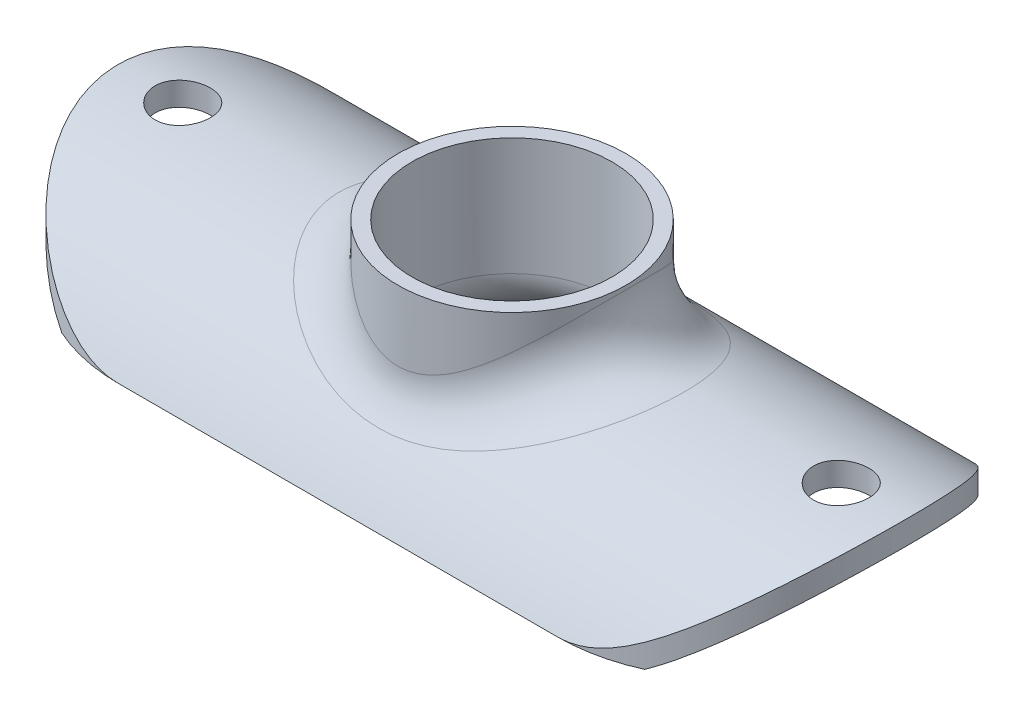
SolidWorks part; units mm, degrees
ref_plane "Plan de face" through (0, 0, 0) normal (0, 0, 1) x (1, 0, 0)
ref_plane "Plan de dessus" through (0, 0, 0) normal (0, 1, 0) x (1, 0, 0)
ref_plane "Plan de droite" through (0, 0, 0) normal (1, 0, 0) x (0, 0, -1)
sketch "Esquisse1" plane through (0, 0, 0) normal (1, 0, 0) x (0, 0, -1)
  line L0 (-13.5, 0) -> (13.5, 0) construction
  line L1 (-14.8182, 0) -> (-13.5, 0)
  line L2 (13.5, 0) -> (14.8182, 0)
  arc A0 (-13.5, 0) -> (13.5, 0) centre (0, -10.332) cw
  arc A1 (-14.8182, 0) -> (14.8182, 0) centre (0, -8.332) cw
  point P7 (0, 0)
  point P8 (-14.7984, 0)
  point P9 (14.8346, 0)
  dimension "D1" = 17
  dimension "D3" = 2
  dimension "D2" = 27
extrude "Boss.-Extru.1" add sketch "Esquisse1" along normal mid plane 67
sketch "Esquisse2" plane through (0, 0, 0) normal (0, 1, 0) x (1, 0, 0)
  line L0 (-18.6818, 0) -> (18.6818, 0) construction
  line L1 (-18.6818, 14.8182) -> (18.6818, 14.8182)
  line L2 (-18.6818, -14.8182) -> (18.6818, -14.8182)
  line L3 (33.5, 14.8182) -> (-33.5, 14.8182) construction
  line L4 (-33.5, 14.8182) -> (-33.5, -14.8182) construction
  line L5 (33.5, -14.8182) -> (33.5, 14.8182) construction
  line L6 (-44.8067, 22.3774) -> (40.3627, 22.3774)
  line L7 (-44.8067, 22.3774) -> (-44.8067, -24.5831)
  line L8 (40.3627, 22.3774) -> (40.3627, -24.5831)
  line L9 (-44.8067, -24.5831) -> (40.3627, -24.5831)
  arc A0 (-18.6818, 14.8182) -> (-18.6818, -14.8182) centre (-18.6818, 0) ccw
  arc A1 (18.6818, -14.8182) -> (18.6818, 14.8182) centre (18.6818, 0) ccw
  circle A2 centre (0, 0) radius 8.5
  point P3 (0, 0)
  point P12 (-33.5, 0)
  point P15 (33.5, 0)
  point P18 (0, 0)
  point P21 (0, 0)
  dimension "D1" = 17
extrude "Enlèv. mat.-Extru.1" cut sketch "Esquisse2" along normal through all contours L7 L9 L8 L6 A1 L2 A0 L1 | L0 A2 | A2 L0
sketch "Esquisse3" plane through (0, 0, 0) normal (0, 1, 0) x (1, 0, 0)
  line L0 (-9.75, 0) -> (9.75, 0) construction
  line L1 (-9.75, 9.75) -> (9.75, 9.75)
  line L2 (-9.75, -9.75) -> (9.75, -9.75)
  arc A0 (-9.75, 9.75) -> (-9.75, -9.75) centre (-9.75, 0) ccw
  arc A1 (9.75, -9.75) -> (9.75, 9.75) centre (9.75, 0) ccw
  circle A2 centre (0, 0) radius 8.5 construction
  circle A3 centre (0, 0) radius 8.5
  point P3 (0, 0)
  point P8 (-19.5, 0)
  point P9 (19.5, 0)
  point P10 (0, 0)
  dimension "D1" = 19.5
  dimension "D2" = 39
extrude "Boss.-Extru.2" add sketch "Esquisse3" along normal up to next
sketch "Esquisse4" plane through (0, 0, 0) normal (0, 1, 0) x (1, 0, 0)
  line L0 (-28, 0) -> (28, 0) construction
  circle A0 centre (-28, 0) radius 2.35
  circle A1 centre (28, 0) radius 2.35
  dimension "D2" = 4.7
  dimension "D1" = 56
extrude "Enlèv. mat.-Extru.2" cut sketch "Esquisse4" along normal through all
sketch "Esquisse5" plane through (0, 0, 0) normal (0, -1, 0) x (1, 0, 0)
  circle A0 centre (0, 0) radius 9.7
  circle A1 centre (0, 0) radius 8.5 construction
  circle A2 centre (0, 0) radius 8.5
  dimension "D1" = 1.2
extrude "Boss.-Extru.3" add sketch "Esquisse5" against normal blind 14
fillet "Congé1" radius 5 1 edges at (-0.2031, 5.6305, 9.6979)
fillet "Congé2" radius 4 1 edges at (0, 0, 8.5)
sketch "Esquisse7" plane through (0, 0, 0) normal (0, -1, 0) x (1, 0, 0)
  line L0 (10.2515, 14.8182) -> (10.2515, 9.7371)
  line L1 (10.2515, 14.8182) -> (9.4515, 14.8182)
  line L2 (10.2515, 9.7371) -> (9.4515, 9.7371)
  line L3 (9.4515, 14.8182) -> (9.4515, 9.7371)
  line L4 (18.6818, 14.8182) -> (-18.6818, 14.8182) construction
  line L5 (-12.6122, 14.8182) -> (-12.6122, 9.3204)
  line L6 (-12.6122, 14.8182) -> (-11.8122, 14.8182)
  line L7 (-12.6122, 9.3204) -> (-11.8122, 9.3204)
  line L8 (-11.8122, 14.8182) -> (-11.8122, 9.3204)
  line L9 (-12.6122, -9.3204) -> (-12.6122, -14.8182)
  line L10 (-12.6122, -9.3204) -> (-11.8122, -9.3204)
  line L11 (-12.6122, -14.8182) -> (-11.8122, -14.8182)
  line L12 (-11.8122, -9.3204) -> (-11.8122, -14.8182)
  line L13 (18.6818, -14.8182) -> (-18.6818, -14.8182) construction
  line L14 (9.75, -9.1748) -> (9.75, -14.8182)
  line L15 (9.75, -9.1748) -> (10.55, -9.1748)
  line L16 (9.75, -14.8182) -> (10.55, -14.8182)
  line L17 (10.55, -9.1748) -> (10.55, -14.8182)
  arc A0 (9.75, -9.75) -> (9.75, 9.75) centre (9.75, 0) ccw construction
  arc A1 (-9.75, 9.75) -> (-9.75, -9.75) centre (-9.75, 0) ccw construction
  point P22 (10.5588, -9.1748)
  dimension "D1" = 0.8
extrude "Boss.-Extru.4" add sketch "Esquisse7" against normal up to surface (3.6032 mm away)
